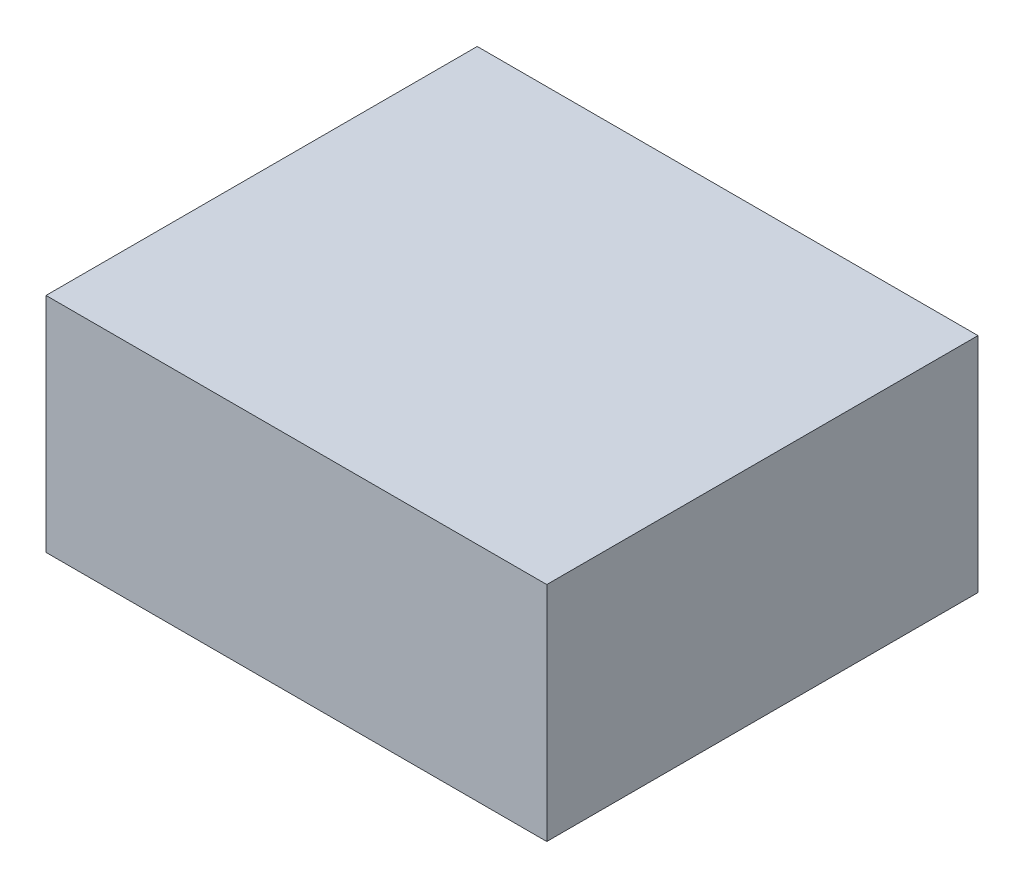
SolidWorks part; units mm, degrees
ref_plane "前视基准面" through (0, 0, 0) normal (0, 0, 1) x (1, 0, 0)
ref_plane "上视基准面" through (0, 0, 0) normal (0, 1, 0) x (1, 0, 0)
ref_plane "右视基准面" through (0, 0, 0) normal (1, 0, 0) x (0, 0, -1)
sketch "草图1" plane through (0, 0, 0) normal (0, 1, 0) x (1, 0, 0)
  line L1 (-9, 7.75) -> (9, 7.75)
  line L2 (-9, 7.75) -> (-9, -7.75)
  line L3 (-9, -7.75) -> (9, -7.75)
  line L4 (9, 7.75) -> (9, -7.75)
  line L5 (-9, 7.75) -> (9, -7.75) construction
  line L6 (-9, -7.75) -> (9, 7.75) construction
  point P0 (0, 0)
  dimension "D1" = 18
  dimension "D2" = 15.5
extrude "凸台-拉伸1" add sketch "草图1" along normal blind 8
